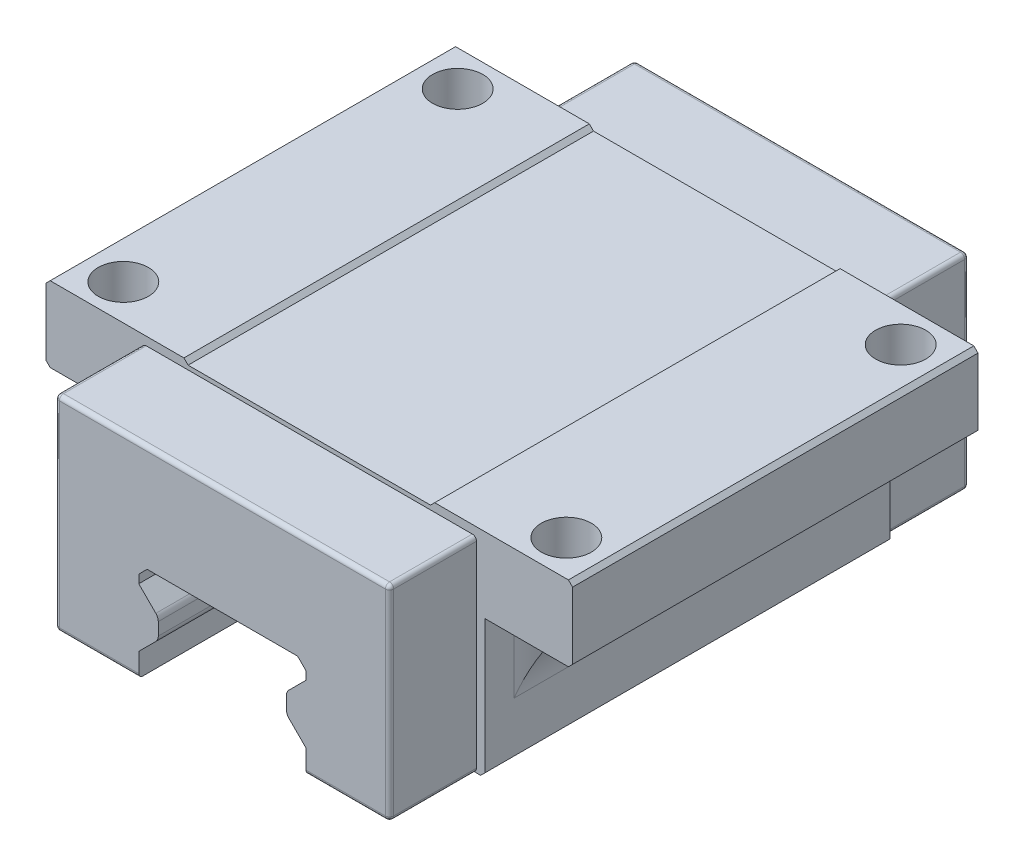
SolidWorks part; units mm, degrees
ref_plane "Front Plane" through (0, 0, 0) normal (0, 0, 1) x (1, 0, 0)
ref_plane "Top Plane" through (0, 0, 0) normal (0, 1, 0) x (1, 0, 0)
ref_plane "Right Plane" through (0, 0, 0) normal (1, 0, 0) x (0, 0, -1)
sketch "Sketch1" plane through (0, 0, 0) normal (0, 0, 1) x (1, 0, 0)
  line L1 (-21, 4.5) -> (21, 4.5)
  line L2 (-21, 4.5) -> (-21, 30)
  line L3 (-21, 30) -> (21, 30)
  line L4 (21, 4.5) -> (21, 30)
  line L5 (-21, 4.5) -> (21, 30) construction
  line L6 (-21, 30) -> (21, 4.5) construction
  point P0 (0, 17.25)
  dimension "D1" = 30
  dimension "D2" = 4.5
  dimension "D3" = 42
extrude "Boss-Extrude1" add sketch "Sketch1" along normal mid plane 48.5
sketch "Sketch2" plane through (0, 0, 0) normal (0, 0, 1) x (1, 0, 0)
  line L0 (-21, 4.5) -> (21, 4.5) construction
  line L1 (-20, 4.5) -> (20, 4.5)
  line L2 (-20, 4.5) -> (-20, 29)
  line L3 (-20, 29) -> (20, 29)
  line L4 (20, 4.5) -> (20, 29)
  line L5 (-20, 29) -> (-21, 29) construction
  line L6 (-21, 30) -> (-21, 4.5) construction
  line L7 (20, 29) -> (20, 30) construction
  line L8 (21, 30) -> (-21, 30) construction
  line L9 (20, 29) -> (21, 29) construction
  line L10 (21, 4.5) -> (21, 30) construction
  point P9 (0, 29)
  dimension "D1" = 1
extrude "Boss-Extrude2" add sketch "Sketch2" along normal mid plane 69.3
sketch "Sketch3" plane through (0, 0, 34.65) normal (0, 0, 1) x (1, 0, 0)
  line L1 (-10, 16.3) -> (10, 16.3)
  line L2 (-10, 16.3) -> (-10, 0)
  line L3 (-10, 0) -> (10, 0)
  line L4 (10, 16.3) -> (10, 0)
  line L5 (-10, 16.3) -> (10, 0) construction
  line L6 (-10, 0) -> (10, 16.3) construction
  point P0 (0, 8.15)
  dimension "D1" = 20
  dimension "D2" = 16.3
extrude "Cut-Extrude1" cut sketch "Sketch3" against normal through all
sketch "Sketch4" plane through (0, 0, 34.65) normal (0, 0, 1) x (1, 0, 0)
  line L0 (-10, 14.3) -> (-10, 7.3)
  line L1 (-10, 16.3) -> (-10, 4.5) construction
  line L2 (-10, 7.3) -> (-7.6667, 9.6333)
  line L3 (-7.6667, 9.6333) -> (-7.6667, 11.9667)
  line L4 (-7.6667, 11.9667) -> (-10, 14.3)
  line L5 (10, 16.3) -> (-10, 16.3) construction
  line L6 (-7.6667, 11.9667) -> (-10, 11.9667) construction
  line L7 (-7.6667, 9.6333) -> (-10, 9.6333) construction
  line L8 (-8.8333, 11.9667) -> (-8.8333, 9.6333) construction
  line L9 (0, 0) -> (0, 16.3) construction
  line L10 (8.8333, 11.9667) -> (8.8333, 9.6333) construction
  line L11 (7.6667, 9.6333) -> (10, 9.6333) construction
  line L12 (7.6667, 11.9667) -> (10, 11.9667) construction
  line L13 (7.6667, 11.9667) -> (10, 14.3)
  line L14 (7.6667, 9.6333) -> (7.6667, 11.9667)
  line L15 (10, 7.3) -> (7.6667, 9.6333)
  line L16 (10, 14.3) -> (10, 7.3)
extrude "Boss-Extrude3" add sketch "Sketch4" against normal up to surface (69.3 mm away)
chamfer "Chamfer1" distance 1 angle 45 2 edges at (10, 16.3, 0) (-10, 16.3, 0)
fillet "Fillet1" radius 1 4 edges at (7.6667, 9.6333, 0) (7.6667, 11.9667, 0) (-7.6667, 9.6333, 0) (-7.6667, 11.9667, 0)
sketch "Sketch5" plane through (0, 0, 24.25) normal (0, 0, 1) x (1, 0, 0)
  line L0 (21, 30) -> (-21, 30) construction
  line L1 (-15, 30) -> (15, 30)
  line L2 (-15, 30) -> (-15, 29.5)
  line L3 (-15, 29.5) -> (15, 29.5)
  line L4 (15, 30) -> (15, 29.5)
  point P6 (0, 29.5)
  dimension "D1" = 30
  dimension "D2" = 0.5
extrude "Cut-Extrude2" cut sketch "Sketch5" against normal through all
chamfer "Chamfer2" distance 0.5 angle 45 6 edges at (21, 30, 0) (21, 4.5, 0) (-21, 4.5, 0) (-21, 30, 0) (15, 29.5, 0) (-15, 29.5, 0)
fillet "Fillet2" radius 0.5 18 edges at (-20, 4.5, -29.45) (15, 4.5, 34.65) (15, 4.5, -34.65) (-20, 4.5, 29.45) (-15, 4.5, -34.65) (-15, 4.5, 34.65) (20, 4.5, 29.45) (-20, 16.75, 34.65) (-20, 16.75, -34.65) (-20, 29, 29.45) (20, 29, 29.45) (20, 16.75, 34.65) (20, 16.75, -34.65) (0, 29, 34.65) (0, 29, -34.65) (20, 4.5, -29.45) (20, 29, -29.45) (-20, 29, -29.45)
sketch "Sketch7" plane through (0, 0, 0) normal (0, 0, 1) x (1, 0, 0)
  line L0 (-20.5, 30) -> (-31.5, 30)
  line L1 (-31.5, 30) -> (-31.5, 21)
  line L2 (-20.5, 30) -> (-20.5, 11)
  line L3 (-21, 29.5) -> (-21, 5) construction
  line L4 (-21, 11) -> (-20.5, 11)
  line L5 (-31.5, 21) -> (-31, 21)
  line L6 (0, 0) -> (0, 29.5) construction
  line L7 (-14.5, 29.5) -> (14.5, 29.5) construction
  line L8 (31.5, 21) -> (31, 21)
  line L9 (21, 11) -> (20.5, 11)
  line L10 (20.5, 30) -> (20.5, 11)
  line L11 (31.5, 30) -> (31.5, 21)
  line L12 (20.5, 30) -> (31.5, 30)
  arc A1 (-31, 21) -> (-21, 11) centre (-31, 11) cw
  arc A2 (31, 21) -> (21, 11) centre (31, 11) ccw
  point P22 (-31.25, 21)
  dimension "D1" = 63
  dimension "D2" = 9
  dimension "D3" = 0.5
extrude "Boss-Extrude4" add sketch "Sketch7" along normal mid plane 31.5
sketch "Sketch8" plane through (0, 0, 0) normal (0, 0, 1) x (1, 0, 0)
  line L0 (-31.5, 21) -> (-31.5, 30)
  line L9 (31.5, 21) -> (31.5, 30)
  line L10 (31.5, 21) -> (20.5, 21)
  line L11 (31.5, 30) -> (20.5, 30)
  line L13 (20.5, 30) -> (20.5, 21)
  line L14 (-31.5, 21) -> (-20, 21)
  line L15 (-31.5, 30) -> (-20, 30)
  line L16 (-20, 21) -> (-20, 30)
  line L17 (-20, 28.5) -> (-20, 5) construction
extrude "Boss-Extrude5" add sketch "Sketch8" along normal mid plane 48.5
chamfer "Chamfer3" distance 0.5 angle 45 4 edges at (-31.5, 21, 0) (-31.5, 30, 0) (31.5, 21, 0) (31.5, 30, 0)
fillet "Fillet3" radius 5 4 edges at (-21, 16, 15.75) (-21, 16, -15.75) (21, 16, -15.75) (21, 16, 15.75)
sketch "Sketch6" plane through (0, 30, 0) normal (0, 1, 0) x (1, 0, 0)
  line L1 (0, 0) -> (26.5, -20) construction
  line L3 (0, 0) -> (-26.5, -20) construction
  circle A1 centre (-26.5, -20) radius 3
  circle A2 centre (26.5, -20) radius 3
  dimension "D1" = 6
  dimension "D2" = 53
  dimension "D3" = 20
extrude "Cut-Extrude3" cut sketch "Sketch6" against normal blind 9
mirror "Mirror1" about plane through (0, 0, 0) normal (0, 0, 1) of "Cut-Extrude3"
equation "\"D2@Sketch4\"=\"D1@Sketch4\"*3.5"
